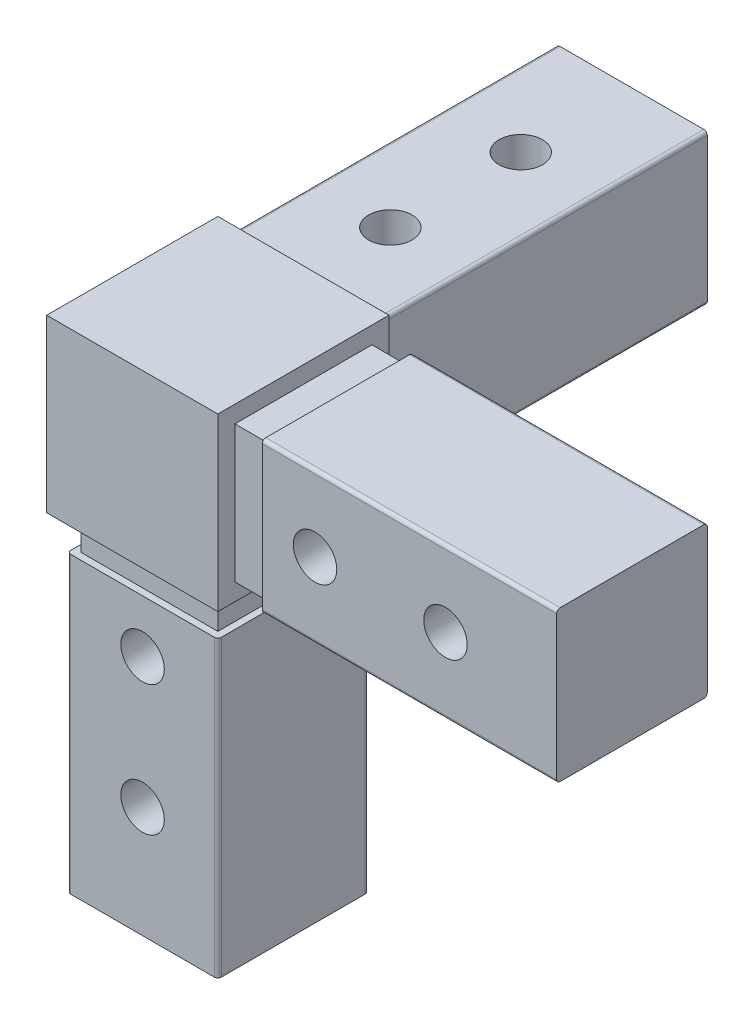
SolidWorks part; units mm, degrees
ref_plane "Front Plane" through (0, 0, 0) normal (0, 0, 1) x (1, 0, 0)
ref_plane "Top Plane" through (0, 0, 0) normal (0, 1, 0) x (1, 0, 0)
ref_plane "Right Plane" through (0, 0, 0) normal (1, 0, 0) x (0, 0, -1)
ref_plane "Plane1" through (0, 0, 10) normal (0, 0, 1) x (1, 0, 0)
sketch "Sketch1" plane through (0, 0, 10) normal (0, 0, 1) x (1, 0, 0)
  line L0 (-10, 10) -> (-10, -12.5)
  line L1 (-10, -12.5) -> (12.5, -12.5)
  line L2 (12.5, -12.5) -> (12.5, 10)
  line L3 (12.5, 10) -> (-10, 10)
extrude "Boss-Extrude1" add sketch "Sketch1" against normal blind 20
sketch "Sketch2" plane through (0, -12.5, 0) normal (0, -1, 0) x (1, 0, 0)
  line L0 (-10, -10) -> (-10, 10)
  line L1 (-10, 10) -> (10, 10)
  line L2 (10, 10) -> (10, -10)
  line L3 (10, -10) -> (-10, -10)
extrude "Boss-Extrude2" add sketch "Sketch2" along normal blind 5
sketch "Sketch3" plane through (12.5, 0, 0) normal (1, 0, 0) x (0, 0, -1)
  line L0 (-10, 10) -> (10, 10)
  line L1 (10, 10) -> (10, -10)
  line L2 (10, -10) -> (-10, -10)
  line L3 (-10, -10) -> (-10, 10)
extrude "Boss-Extrude3" add sketch "Sketch3" along normal blind 5
sketch "Sketch4" plane through (17.5, 0, 0) normal (1, 0, 0) x (0, 0, -1)
  line L0 (11, -10) -> (-10, -10)
  line L1 (-10, -10) -> (-10, 11)
  line L2 (-10, 11) -> (11, 11)
  line L3 (11, 11) -> (11, -10)
extrude "Boss-Extrude4" add sketch "Sketch4" along normal blind 43
ref_plane "Plane2" through (0, -17.5, 0) normal (0, 1, 0) x (1, 0, 0)
sketch "Sketch5" plane through (0, -17.5, 0) normal (0, 1, 0) x (1, 0, 0)
  line L0 (-11, 11) -> (-11, -11)
  line L1 (-11, -11) -> (11, -11)
  line L2 (11, -11) -> (11, 11)
  line L3 (11, 11) -> (-11, 11)
extrude "Boss-Extrude5" add sketch "Sketch5" against normal blind 43
sketch "Sketch6" plane through (0, 10, 0) normal (0, 1, 0) x (-1, 0, 0)
  line L0 (-12.5, 10) -> (10, 10)
  line L1 (10, 10) -> (10, -10)
  line L2 (10, -10) -> (-12.5, -10)
  line L3 (-12.5, -10) -> (-12.5, 10)
extrude "Boss-Extrude6" add sketch "Sketch6" along normal blind 2.5
sketch "Sketch7" plane through (0, 0, 10) normal (0, 0, 1) x (1, 0, 0)
  line L0 (-10, 12.5) -> (12.5, 12.5)
  line L1 (12.5, 12.5) -> (12.5, -12.5)
  line L2 (12.5, -12.5) -> (-10, -12.5)
  line L3 (-10, -12.5) -> (-10, 12.5)
extrude "Boss-Extrude7" add sketch "Sketch7" along normal blind 2.5
sketch "Sketch8" plane through (-10, 0, 0) normal (-1, 0, 0) x (0, 0, 1)
  line L0 (-10, 12.5) -> (12.5, 12.5)
  line L1 (12.5, 12.5) -> (12.5, -12.5)
  line L2 (12.5, -12.5) -> (-10, -12.5)
  line L3 (-10, -12.5) -> (-10, 12.5)
extrude "Boss-Extrude8" add sketch "Sketch8" along normal blind 2.5
sketch "Sketch9" plane through (0, 0, -10) normal (0, 0, -1) x (-1, 0, 0)
  line L0 (12.5, -12.5) -> (-12.5, -12.5)
  line L1 (-12.5, -12.5) -> (-12.5, 12.5)
  line L2 (-12.5, 12.5) -> (12.5, 12.5)
  line L3 (12.5, 12.5) -> (12.5, -12.5)
extrude "Boss-Extrude9" add sketch "Sketch9" along normal blind 2.5
sketch "Sketch10" plane through (0, -10, 0) normal (0, -1, 0) x (1, 0, 0)
  line L0 (60.5, 10) -> (60.5, -11)
  line L1 (60.5, -11) -> (17.5, -11)
  line L2 (17.5, -11) -> (17.5, 10)
  line L3 (17.5, 10) -> (60.5, 10)
extrude "Boss-Extrude10" add sketch "Sketch10" along normal blind 1
sketch "Sketch11" plane through (0, 0, 10) normal (0, 0, 1) x (1, 0, 0)
  line L0 (60.5, 11) -> (60.5, -11)
  line L1 (60.5, -11) -> (17.5, -11)
  line L2 (17.5, -11) -> (17.5, 11)
  line L3 (17.5, 11) -> (60.5, 11)
extrude "Boss-Extrude11" add sketch "Sketch11" along normal blind 1
sketch "Sketch12" plane through (0, 0, -12.5) normal (0, 0, -1) x (-1, 0, 0)
  line L0 (11, -11) -> (-11, -11)
  line L1 (-11, -11) -> (-11, 11)
  line L2 (-11, 11) -> (11, 11)
  line L3 (11, 11) -> (11, -11)
extrude "Boss-Extrude12" add sketch "Sketch12" along normal blind 48
fillet "Fillet1" radius 0.5 12 edges at (-11, -39, 11) (39, -11, 11) (39, 11, -11) (11, -11, -36.5) (11, -39, 11) (11, 11, -36.5) (39, 11, 11) (-11, 11, -36.5) (39, -11, -11) (-11, -39, -11) (-11, -11, -36.5) (11, -39, -11)
sketch "Sketch13" plane through (0, 0, 11) normal (0, 0, 1) x (1, 0, 0)
  line L0 (17.5, 0) -> (60.5, 0) construction
  line L1 (17.5, 10.5) -> (17.5, -10.5) construction
  line L2 (60.5, -10.5) -> (60.5, 10.5) construction
  line L3 (12.5, -10) -> (12.5, 10) construction
  circle A0 centre (44.25, 0) radius 3.175
  circle A1 centre (25.2, 0) radius 3.175
  dimension "D1" = 6.35
  dimension "D2" = 6.35
  dimension "D3" = 12.7
  dimension "D4" = 31.75
extrude "Cut-Extrude1" cut sketch "Sketch13" against normal up to surface (22 mm away)
sketch "Sketch15" plane through (0, 0, 11) normal (0, 0, 1) x (1, 0, 0)
  line L0 (0, -60.5) -> (0, -17.5) construction
  line L1 (-10.5, -60.5) -> (10.5, -60.5) construction
  line L2 (11.55, -17.5) -> (-11.55, -17.5) construction
  line L3 (-10, -12.5) -> (10, -12.5) construction
  circle A0 centre (0, -44.25) radius 3.175
  circle A1 centre (0, -25.2) radius 3.175
  dimension "D1" = 6.35
  dimension "D2" = 6.35
  dimension "D3" = 12.7
  dimension "D4" = 31.75
extrude "Cut-Extrude2" cut sketch "Sketch15" against normal up to surface (22 mm away)
ref_plane "Plane3" through (-10.5, -60.5, -11) normal (0, 1, 0) x (1, 0, 0)
sketch "Sketch17" plane through (0, 11, 0) normal (0, 1, 0) x (1, 0, 0)
  line L0 (0, 60.5) -> (0, 12.5) construction
  line L1 (-10.5, 60.5) -> (10.5, 60.5) construction
  line L2 (-12.5, 12.5) -> (12.5, 12.5) construction
  line L3 (-10.5, 12.5) -> (10.5, 12.5) construction
  circle A0 centre (0, 44.25) radius 3.175
  circle A1 centre (0, 25.2) radius 3.175
  dimension "D3" = 6.35
  dimension "D4" = 6.35
  dimension "D1" = 12.7
  dimension "D2" = 31.75
extrude "Cut-Extrude4" cut sketch "Sketch17" against normal up to surface (22 mm away)
